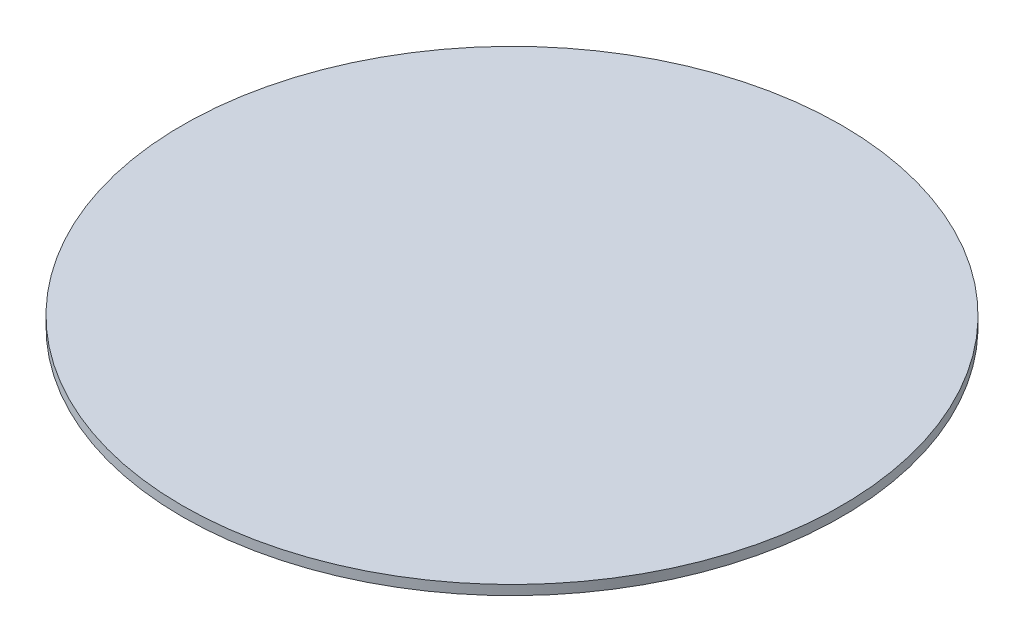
SolidWorks part; units mm, degrees
ref_plane "Front Plane" through (0, 0, 0) normal (0, 0, 1) x (1, 0, 0)
ref_plane "Top Plane" through (0, 0, 0) normal (0, 1, 0) x (1, 0, 0)
ref_plane "Right Plane" through (0, 0, 0) normal (1, 0, 0) x (0, 0, -1)
sketch "Sketch1" plane through (0, 0, 0) normal (0, 1, 0) x (1, 0, 0)
  circle A0 centre (0, 0) radius 37.5
  dimension "D1" = 75
extrude "Boss-Extrude1" add sketch "Sketch1" along normal blind 1.1
